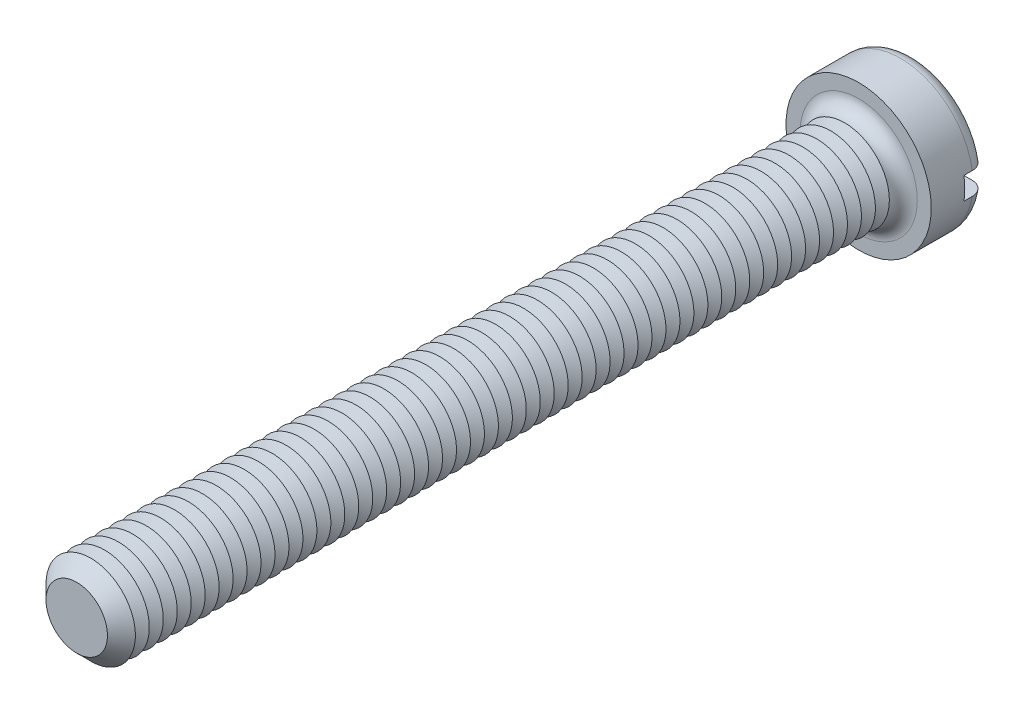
SolidWorks part; units mm, degrees
ref_plane "Front Plane" through (0, 0, 0) normal (0, 0, 1) x (1, 0, 0)
ref_plane "Top Plane" through (0, 0, 0) normal (0, 1, 0) x (1, 0, 0)
ref_plane "Right Plane" through (0, 0, 0) normal (1, 0, 0) x (0, 0, -1)
sketch "Sketch3" plane through (0, 0, 0) normal (0, 0, 1) x (1, 0, 0)
  circle A0 centre (0, 0) radius 6.5
  dimension "D1" = 13
extrude "Boss-Extrude2" add sketch "Sketch3" against normal blind 5
sketch "Sketch4" plane through (0, 0, 0) normal (0, 0, 1) x (1, 0, 0)
  circle A0 centre (0, 0) radius 4
  dimension "D1" = 8
extrude "Boss-Extrude3" add sketch "Sketch4" along normal blind 70
fillet "Fillet1" radius 1.25 2 edges at (6.5, 0, -5) (4, 0, 0)
chamfer "Chamfer1" distance 1.25 angle 45 1 edges at (4, 0, 70)
sketch "Sketch5" plane through (0, 0, 0) normal (1, 0, 0) x (0, 0, -1)
  line L0 (1.6944, 0) -> (-7.6738, 0) construction
sketch "Sketch6" plane through (0, 0, 0) normal (1, 0, 0) x (0, 0, -1)
  line L0 (-1.25, 4) -> (-1.875, 2.9175)
  line L1 (-1.875, 2.9175) -> (-2.5, 4)
  line L2 (-1.25, 4) -> (-68.75, 4) construction
  line L3 (-2.5, 4) -> (-1.25, 4)
  dimension "D1" = 1.25
revolve "Cut-Revolve1" cut sketch "Sketch6" angle 360 about L0
pattern_linear "LPattern1" count 54 spacing 1.25 along (0, 0, 1) of "Cut-Revolve1"
sketch "Sketch8" plane through (0, 0, -5) normal (0, 0, -1) x (-1, 0, 0)
  line L1 (6.5, -1) -> (-6.5, -1)
  line L2 (6.5, -1) -> (6.5, 1)
  line L3 (6.5, 1) -> (-6.5, 1)
  line L4 (-6.5, -1) -> (-6.5, 1)
  line L5 (6.5, -1) -> (-6.5, 1) construction
  line L6 (6.5, 1) -> (-6.5, -1) construction
  point P0 (0, 0)
  dimension "D1" = 13
  dimension "D2" = 2
extrude "Cut-Extrude1" cut sketch "Sketch8" against normal blind 2
